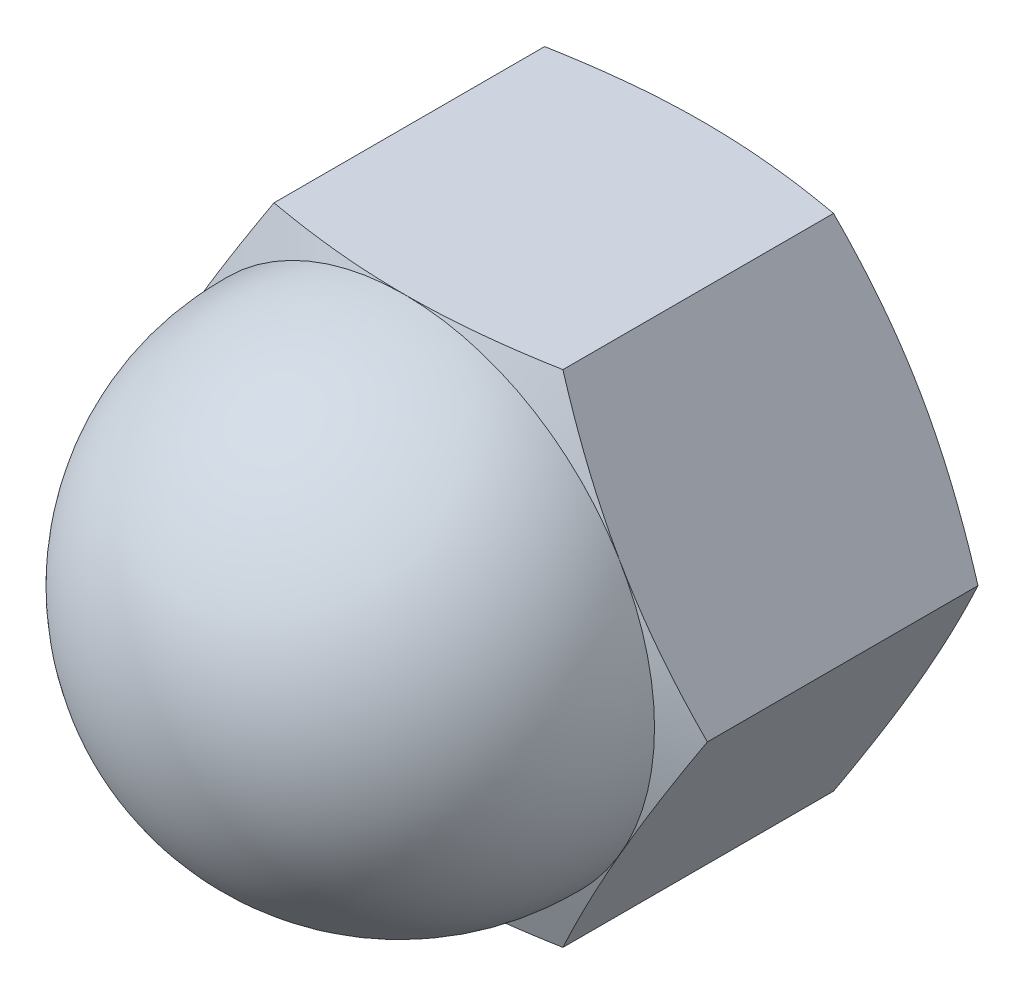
SolidWorks part; units mm, degrees
ref_plane "Front" through (0, 0, 0) normal (0, 0, 1) x (1, 0, 0)
ref_plane "Top" through (0, 0, 0) normal (0, 1, 0) x (1, 0, 0)
ref_plane "Right" through (0, 0, 0) normal (1, 0, 0) x (0, 0, -1)
sketch "Sketch1" plane through (0, 0, 0) normal (0, 0, 1) x (1, 0, 0)
  line L1 (7.5056, 0) -> (3.7528, 6.5)
  line L2 (3.7528, 6.5) -> (-3.7528, 6.5)
  line L3 (-3.7528, 6.5) -> (-7.5056, 0)
  line L4 (-7.5056, 0) -> (-3.7528, -6.5)
  line L5 (-3.7528, -6.5) -> (3.7528, -6.5)
  line L6 (3.7528, -6.5) -> (7.5056, 0)
  circle A0 centre (0, 0) radius 6.5 construction
  circle A1 centre (0, 0) radius 3.3235
  dimension "d" = 6.647
  dimension "s" = 13
extrude "BaseNut" add sketch "Sketch1" against normal blind 8
sketch "Sketch2" plane through (0, 0, 0) normal (0, 1, 0) x (1, 0, 0)
  line L0 (-6.175, 8) -> (-7.5056, 8)
  line L2 (-7.5056, 8) -> (-7.5056, 7.5157)
  line L4 (-7.5056, 7.5157) -> (-6.175, 8)
  line L5 (0, 11.5694) -> (0, -9.1399) construction
  line L7 (-7.1748, 4) -> (8.0192, 4) construction
  line L8 (-7.5056, 0.4843) -> (-6.175, 0)
  line L9 (-7.5056, 0) -> (-7.5056, 0.4843)
  line L10 (-6.175, 0) -> (-7.5056, 0)
  line L11 (-3.7528, 0) -> (-7.5056, 0) construction
  dimension "D1" = 12.35
  dimension "Angle" = 20
  dimension "h1" = 4
revolve "DoubleChamfer" cut sketch "Sketch2" angle 360 about L5
sketch "Sketch3" plane through (-4.6, 0, -7.9176) normal (0, 1, 0) x (-1, 0, 0)
  line L2 (-4.6, 5.9176) -> (-10.7847, 5.9176)
  line L3 (-4.6, 5.0684) -> (-4.6, 5.9176) construction
  line L4 (-7.9235, -0.0824) -> (-1.2765, -0.0824) construction
  line L8 (-4.6, 14.4176) -> (-4.6, 5.9176)
  line L11 (-10.775, -0.0824) -> (1.575, -0.0824) construction
  arc A0 (-4.6, 14.4176) -> (-10.7847, 5.9176) centre (-4.6, 7.9176) ccw
  dimension "R" = 6.5
  dimension "h" = 8
  dimension "b" = 6
revolve "Crown" add sketch "Sketch3" angle 360 about L3
chamfer "EndChamfer" distance 0.8765 angle 30 1 edges at (3.3235, 0, -8)
sketch "Sketch4" plane through (0, 0, 0) normal (0, 1, 0) x (1, 0, 0)
  line L0 (0, 7.6611) -> (0, -9.4764) construction
  line L1 (2.647, 7.4617) -> (2.647, 6.7852)
  line L2 (2.647, 6.7852) -> (3.3235, 6.7852)
  line L3 (3.3235, 6.7852) -> (3.9094, 7.1235)
  line L4 (3.9094, 7.1235) -> (3.3235, 7.4617)
  line L5 (2.647, 7.4617) -> (3.3235, 7.4617)
  line L6 (-3.3235, 7.1235) -> (3.3235, 7.1235) construction
  dimension "D1" = 6.647
  dimension "D2" = 0.6765
revolve "Cut-Revolve10" [suppressed] cut sketch "Sketch4" angle 360 about L0
pattern_linear "LPattern10" [suppressed] count 10 spacing 0.8118 along (0, 0, 1)
equation "\"D1@Sketch2\" = 0.95 * \"s@Sketch1\""
equation "\"h1@Sketch2\" = \"h@Sketch3\" / 2"
equation "\"h@BaseNut\" = \"h@Sketch3\""
equation "\"D1@Sketch4\" = \"d@Sketch1\""
equation "\"D2@Sketch4\" =  ( \"D2@ThreadCosmetic1\" - \"d@Sketch1\" )  / 2"
equation "\"D3@LPattern10\" = \"D2@Sketch4\" * 1.2"
equation "\"D1@LPattern10\" = \"h@BaseNut\" / \"D3@LPattern10\""
